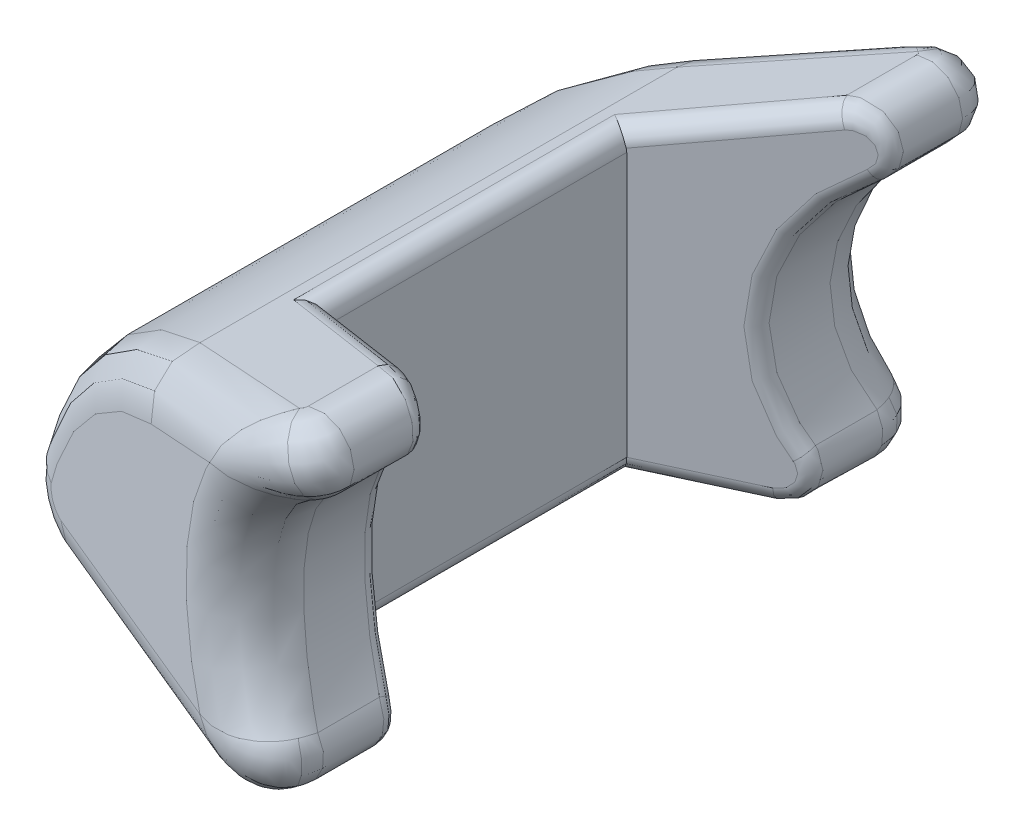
SolidWorks part; units mm, degrees
ref_plane "Face" through (0, 0, 0) normal (0, 0, 1) x (1, 0, 0)
ref_plane "Dessus" through (0, 0, 0) normal (0, 1, 0) x (1, 0, 0)
ref_plane "Droite" through (0, 0, 0) normal (1, 0, 0) x (0, 0, -1)
sketch "Esquisse2" plane through (0, 0, 0) normal (0, 0, 1) x (1, 0, 0)
  line L1 (-200.3273, 174.7842) -> (-302.6138, 136.6774)
  line L3 (-382.7255, -34.6165) -> (-225.6449, -34.6165)
  arc A0 (-182.1676, 139.4575) -> (-209.1797, -3.2633) centre (-125.0681, 54.7339) ccw
  arc A2 (-182.1676, 139.4575) -> (-200.3273, 174.7842) centre (-193.3451, 156.0425) ccw
  arc A3 (-225.6449, -34.6165) -> (-209.1797, -3.2633) centre (-225.6449, -14.6165) ccw
  arc A4 (-382.7255, -34.6165) -> (-421.1472, 16.5092) centre (-382.7255, 5.3835) cw
  arc A6 (-302.6138, 136.6774) -> (-421.1472, 16.5092) centre (-232.7919, -50.739) ccw
  dimension "D1" = 20
  dimension "D2" = 40
  dimension "D3" = 40
  dimension "D4" = 400
extrude "Base-Extrusion" add sketch "Esquisse2" along normal mid plane 780
sketch "Esquisse3" plane through (0, -34.6165, 0) normal (0, -1, 0) x (1, 0, 0)
  line L0 (0, 0) -> (-516.6204, 0) construction
  line L1 (-130, 240) -> (-480, 95.0253)
  line L2 (-130, -240) -> (-480, -95.0253)
  line L3 (-130, 240) -> (-130, 158)
  line L4 (-130, -240) -> (-130, -158)
  line L5 (-130, 158) -> (-280, 88.0539)
  line L6 (-130, -158) -> (-280, -88.0539)
  line L7 (-280, 88.0539) -> (-280, -88.0539)
  line L8 (-480, -95.0253) -> (-480, 95.0253)
  line L10 (0, 550) -> (-575, 550)
  line L11 (0, 550) -> (0, -513.6989)
  line L12 (0, -513.6989) -> (-575, -513.6989)
  line L13 (-575, 550) -> (-575, -513.6989)
  dimension "D1" = 130
  dimension "D2" = 150
  dimension "D3" = 350
  dimension "D4" = 240
  dimension "D5" = 22.5
  dimension "D6" = 25
  dimension "D7" = 158
  dimension "D8" = 550
  dimension "D9" = 575
extrude "Enlèv. mat.-Extru.1" cut sketch "Esquisse3" against normal through all
fillet "Congé1" radius 30 14 edges at (-375.1785, 89.7105, 138.4437) (-375.1785, 89.7105, -138.4437) (-304.1852, -34.6165, -167.8501) (-414.7023, -18.6474, -122.0724) (-251.4705, 155.7308, -189.6853) (-175.5576, 165.1862, -221.1294) (-304.1852, -34.6165, 167.8501) (-207.9381, -23.9153, 207.717) (-225.4546, 73.7336, 200.4614) (-175.5576, 165.1862, 221.1294) (-225.4546, 73.7336, -200.4614) (-207.9381, -23.9153, -207.717) (-414.7023, -18.6474, 122.0724) (-251.4705, 155.7308, 189.6853)
fillet "Congé3" radius 10 12 edges at (-240.1636, 159.9432, -106.6299) (-280, 145.1022, 0) (-240.1636, 159.9432, 106.6299) (-252.8225, -34.6165, 100.7269) (-225.4546, 73.7336, 113.4888) (-207.9381, -23.9153, 121.6569) (-175.5576, 165.1862, 136.7561) (-280, -34.6165, 0) (-252.8225, -34.6165, -100.7269) (-207.9381, -23.9153, -121.6569) (-225.4546, 73.7336, -113.4888) (-175.5576, 165.1862, -136.7561)
